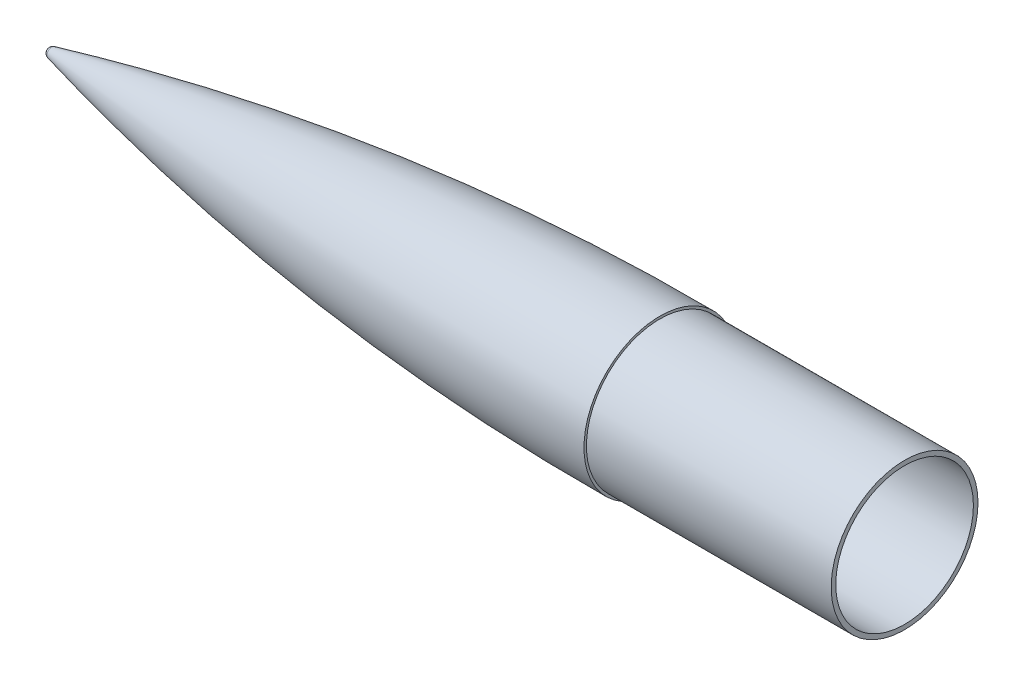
SolidWorks part; units mm, degrees
ref_plane "Front Plane" through (0, 0, 0) normal (0, 0, 1) x (1, 0, 0)
ref_plane "Top Plane" through (0, 0, 0) normal (0, 1, 0) x (1, 0, 0)
ref_plane "Right Plane" through (0, 0, 0) normal (1, 0, 0) x (0, 0, -1)
sketch "Sketch1" plane through (0, 0, 0) normal (0, 0, 1) x (1, 0, 0)
  line L0 (0, 0) -> (13.105, 0) construction
  line L1 (325.525, 0) -> (325.525, 38.1) construction
  line L2 (8.025, 0) -> (8.025, 30.9534) construction
  line L3 (452.525, 0) -> (325.525, 0) construction
  line L4 (325.525, 38.1) -> (452.525, 38.1)
  line L5 (452.525, 38.1) -> (452.525, 35.7187)
  line L6 (325.525, 38.1) -> (325.525, 39.37)
  line L7 (8.025, 0) -> (9.8947, 0)
  line L11 (325.525, 38.1) -> (325.525, 39.37) construction
  line L12 (325.525, 35.7187) -> (452.525, 35.7187)
  line L13 (452.525, 35.7187) -> (452.525, 0) construction
  line L15 (325.525, 35.7187) -> (325.5107, 36.9888)
  line L16 (325.525, 0) -> (13.105, 0) construction
  arc A1 (9.9641, 2.4679) -> (8.025, 0) centre (10.565, 0) ccw
  arc A2 (325.525, 39.37) -> (9.9641, 2.4679) centre (317.6933, -1261.3375) ccw
  arc A3 (13.105, 0) -> (9.9641, 2.4679) centre (10.565, 0) ccw construction
  arc A4 (8.025, 0) -> (13.105, 0) centre (10.565, 0) ccw construction
  arc A5 (8.025, 1.9942) -> (0, 0) centre (317.6933, -1261.3375) ccw construction
  arc A6 (9.9641, 2.4679) -> (8.025, 1.9942) centre (317.6933, -1261.3375) ccw construction
  arc A7 (325.5107, 36.9888) -> (9.8947, 0) centre (317.6933, -1261.3375) ccw
  arc A8 (325.5107, 36.9888) -> (10.5275, 0.1542) centre (317.6933, -1261.3375) ccw construction
  point P4 (10.565, 0)
  point P5 (9.9641, 2.4679)
  point P11 (8.025, 0)
revolve "Revolve1" add sketch "Sketch1" angle 360 about L16
equation "\"r_n\"= 0.1'nose tip radius"
equation "\"R_nc\"= 3.1 / 2'nosecone base radius"
equation "\"L_nc\"= 12.5'exposed length of the nosecone"
equation "\"rho\"= ( \"R_nc\" ^ 2 + \"L_nc\" ^ 2 ) / ( 2 * \"R_nc\" )'ogive radius"
equation "\"x_0\"= \"L_nc\" - sqr ( ( \"rho\" - \"r_n\" ) ^ 2 - ( \"rho\" - \"R_nc\" ) ^ 2 )'center of tip sphere"
equation "\"y_t\"= \"r_n\" * ( \"rho\" - \"R_nc\" ) / ( \"rho\" - \"r_n\" )'y-coordinate of tangency point"
equation "\"x_t\"= \"x_0\" - sqr ( \"r_n\" ^ 2 - \"y_t\" ^ 2 )'x-coordinate of tangency point"
equation "\"x_a\"= \"x_0\" - \"r_n\"'apex point"
equation "\"D1@Sketch1\"=\"R_nc\""
equation "\"D2@Sketch1\"=\"x_0\""
equation "\"D3@Sketch1\"=\"y_t\""
equation "\"D4@Sketch1\"=\"x_t\""
equation "\"D5@Sketch1\"=\"L_nc\""
equation "\"t_nc\"= 3 / 32'wall thickness of nosecone"
equation "\"L_s\"= 5'length of shoulder"
equation "\"R_s\"= 3 / 2'radius of shoulder"
equation "\"t_s\"= 3 / 32'wall thickness of shoulder"
equation "\"D6@Sketch1\"=\"R_s\""
equation "\"D8@Sketch1\"=\"t_nc\""
equation "\"D9@Sketch1\"=\"t_s\""
